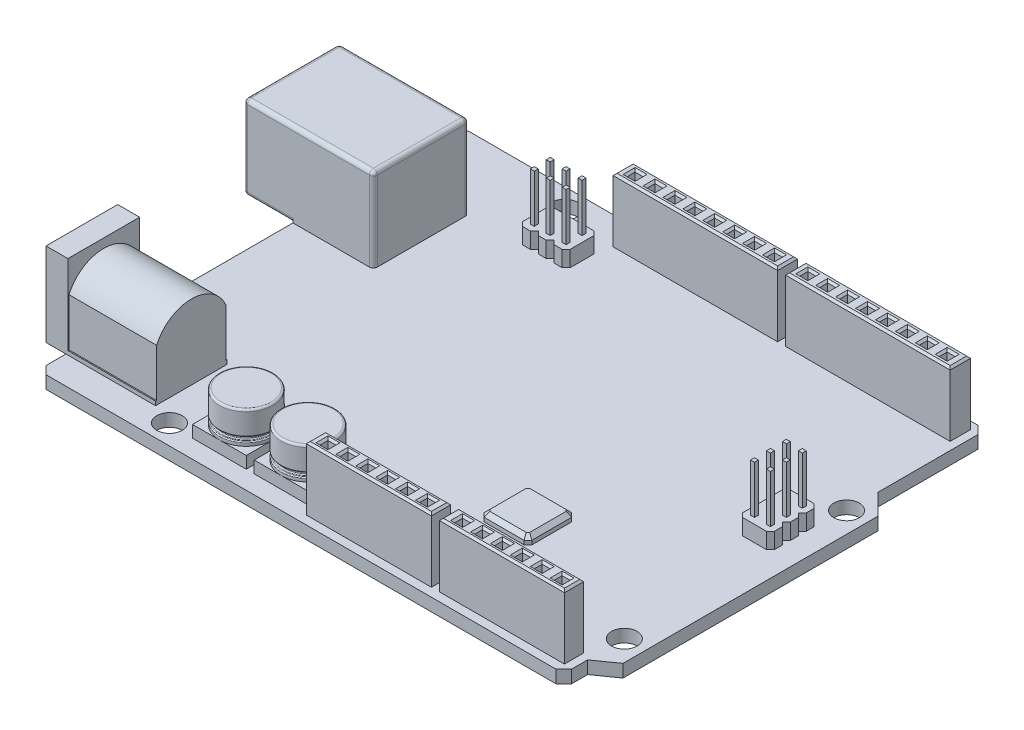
SolidWorks part; units mm, degrees
ref_plane "Front Plane" through (0, 0, 0) normal (0, 0, 1) x (1, 0, 0)
ref_plane "Top Plane" through (0, 0, 0) normal (0, 1, 0) x (1, 0, 0)
ref_plane "Right Plane" through (0, 0, 0) normal (1, 0, 0) x (0, 0, -1)
sketch "Sketch1" plane through (0, 0, 0) normal (0, 1, 0) x (1, 0, 0)
  line L0 (33, 12.9334) -> (35.6, 10.3334)
  line L1 (-33, -26.5) -> (33, -26.5)
  line L2 (-33, -26.5) -> (-33, 26.5)
  line L3 (-33, 26.5) -> (33, 26.5)
  line L4 (33, -26.5) -> (33, -23.5)
  line L5 (-33, -26.5) -> (33, 26.5) construction
  line L6 (-33, 26.5) -> (33, -26.5) construction
  line L7 (35.6, 10.3334) -> (35.6, -21.6666)
  line L8 (35.6, -21.6666) -> (33, -23.5)
  line L9 (33, 12.9334) -> (33, 26.5)
  line L10 (-19, -24) -> (-19, 24) construction
  circle A0 centre (-17.4, 24) radius 1.6
  circle A1 centre (-19, -24) radius 1.6
  circle A2 centre (33, 9) radius 1.6
  circle A3 centre (33, -18.9) radius 1.6
  point P0 (0, 0)
  dimension "D3" = 3.2
  dimension "D8" = 3.2
  dimension "D1" = 66
  dimension "D2" = 53
  dimension "D4" = 3
  dimension "D5" = 32
  dimension "D6" = 45
  dimension "D7" = 68.6
  dimension "D9" = 27.9
  dimension "D10" = 5.1
  dimension "D11" = 2.5
  dimension "D12" = 2.5
  dimension "D13" = 14
extrude "Boss-Extrude1" add sketch "Sketch1" along normal blind 1.6
chamfer "Chamfer1" distance 1 angle 45 4 edges at (-33, 0.8, 26.5) (-33, 0.8, -26.5) (33, 0.8, -26.5) (33, 0.8, 26.5)
sketch "Sketch2" plane through (0, 1.6, 0) normal (0, 1, 0) x (1, 0, 0)
  line L0 (32, 26.5) -> (-32, 26.5) construction
  line L1 (-22.9, 5.5) -> (-39.2, 5.5)
  line L2 (-22.9, 5.5) -> (-22.9, 17.5)
  line L3 (-22.9, 17.5) -> (-39.2, 17.5)
  line L4 (-39.2, 5.5) -> (-39.2, 17.5)
  line L5 (-35.5, -14) -> (-21.75, -14)
  line L6 (-35.5, -14) -> (-35.5, -23)
  line L7 (-35.5, -23) -> (-21.75, -23)
  line L8 (-21.75, -14) -> (-21.75, -23)
  line L9 (-33, 25.5) -> (-33, -25.5) construction
  line L10 (-32, -26.5) -> (32, -26.5) construction
  dimension "D1" = 12
  dimension "D2" = 16.3
  dimension "D3" = 9
  dimension "D4" = 6.2
  dimension "D5" = 9
  dimension "D6" = 13.75
  dimension "D7" = 2.5
  dimension "D8" = 3.5
extrude "Boss-Extrude2" add sketch "Sketch2" along normal blind 10.5
sketch "Sketch3" plane through (-39.2, 0, 0) normal (-1, 0, 0) x (0, 0, 1)
  line L0 (-11.5, 12.1) -> (-11.5, 1.6) construction
  line L1 (-17.5, 12.1) -> (-5.5, 12.1) construction
  line L2 (-17.5, 1.6) -> (-5.5, 1.6) construction
  line L3 (-9.1605, 10.6) -> (-13.8395, 10.6)
  line L4 (-13.8395, 10.6) -> (-16, 8.1518)
  line L5 (-16, 8.1518) -> (-16, 3.1)
  line L6 (-16, 3.1) -> (-7, 3.1)
  line L7 (-8.81, 8.1518) -> (-14.19, 8.1518)
  line L8 (-14.19, 8.1518) -> (-14.19, 5.6518)
  line L9 (-14.19, 5.6518) -> (-11.5, 5.6518)
  line L10 (-8.81, 8.1518) -> (-8.81, 5.6518)
  line L11 (-8.81, 5.6518) -> (-11.5, 5.6518)
  line L12 (-7, 8.1518) -> (-7, 3.1)
  line L13 (-9.1605, 10.6) -> (-7, 8.1518)
  point P8 (-10.155, 5.6518)
  point P13 (-12.845, 5.6518)
  point P17 (-11.5, 3.1)
  point P19 (-11.5, 8.1518)
  point P22 (-11.5, 10.6)
  dimension "D1" = 9
  dimension "D2" = 2.5
  dimension "D3" = 7.5
  dimension "D4" = 1.5
  dimension "D5" = 5.38
extrude "Cut-Extrude1" cut sketch "Sketch3" against normal blind 10
fillet "Fillet2" radius 0.5 11 edges at (-36.1, 1.6, -17.5) (-39.2, 1.6, -11.5) (-36.1, 1.6, -5.5) (-22.9, 12.1, -11.5) (-31.05, 12.1, -17.5) (-39.2, 12.1, -11.5) (-22.9, 6.85, -5.5) (-39.2, 6.85, -5.5) (-39.2, 6.85, -17.5) (-22.9, 6.85, -17.5) (-31.05, 12.1, -5.5)
sketch "Sketch4" plane through (-35.5, 0, 0) normal (-1, 0, 0) x (0, 0, 1)
  line L0 (18.5, 12.1) -> (18.5, 1.6) construction
  line L1 (14, 12.1) -> (23, 12.1) construction
  line L2 (14, 1.6) -> (23, 1.6) construction
  line L3 (14, 6.85) -> (23, 6.85) construction
  line L4 (14, 12.1) -> (14, 1.6) construction
  line L5 (23, 12.1) -> (23, 1.6) construction
  circle A0 centre (18.5, 6.85) radius 3.5
  circle A1 centre (18.5, 6.85) radius 0.5
  dimension "D1" = 7
  dimension "D2" = 1
extrude "Cut-Extrude2" cut sketch "Sketch4" against normal blind 10
sketch "Sketch6" plane through (-21.75, 0, 0) normal (1, 0, 0) x (0, 0, -1)
  line L0 (-23, 2.1) -> (-14, 2.1) construction
  line L1 (-23, 12.1) -> (-23, 1.6) construction
  line L2 (-14, 12.1) -> (-14, 1.6) construction
  line L3 (-18.5, 12.1) -> (-18.5, 2.1) construction
  line L4 (-23, 12.1) -> (-14, 12.1) construction
  line L5 (-23, 1.6) -> (-14, 1.6) construction
  line L6 (-14, 12.1) -> (-23, 12.1)
  line L7 (-23, 12.1) -> (-23, 2.1)
  line L8 (-23, 2.1) -> (-22.86, 2.1)
  line L9 (-22.86, 2.1) -> (-22.86, 8.1)
  line L10 (-14, 2.1) -> (-14.14, 2.1)
  line L11 (-14.14, 2.1) -> (-14.14, 8.1)
  line L12 (-14, 12.1) -> (-14, 2.1)
  arc A1 (-22.86, 8.1) -> (-14.14, 8.1) centre (-18.5, 6.2062) cw
  dimension "D1" = 0.5
  dimension "D2" = 0.14
  dimension "D3" = 6
extrude "Cut-Extrude5" cut sketch "Sketch6" against normal blind 11
fillet "Fillet3" radius 0.5 1 edges at (-35.5, 6.85, 19)
sketch "Sketch7" plane through (0, 1.6, 0) normal (0, 1, 0) x (1, 0, 0)
  line L0 (33, 12.9334) -> (33, 25.5) construction
  line L1 (-10.3, 25.5) -> (10.35, 25.5)
  line L2 (-10.3, 25.5) -> (-10.3, 23)
  line L3 (-10.3, 23) -> (10.35, 23)
  line L4 (10.35, 25.5) -> (10.35, 23)
  line L5 (11.35, 25.5656) -> (32, 25.5656)
  line L6 (11.35, 25.5656) -> (11.35, 23)
  line L7 (11.35, 23) -> (32, 23)
  line L8 (32, 25.5656) -> (32, 23)
  line L9 (-0.4, -23) -> (15.3, -23)
  line L10 (-0.4, -23) -> (-0.4, -25.4147)
  line L11 (-0.4, -25.4147) -> (15.3, -25.4147)
  line L12 (15.3, -23) -> (15.3, -25.4147)
  line L13 (16.3, -23) -> (32, -23)
  line L14 (16.3, -23) -> (16.3, -25.4147)
  line L15 (16.3, -25.4147) -> (32, -25.4147)
  line L16 (32, -23) -> (32, -25.4147)
  line L17 (-10.3, 24.25) -> (10.35, 24.25) construction
  line L18 (-6.8, 24.75) -> (-6.8, 23.75)
  line L19 (-9.3, 24.75) -> (-8.3, 24.75)
  line L20 (-9.3, 24.75) -> (-9.3, 23.75)
  line L21 (-9.3, 23.75) -> (-8.3, 23.75)
  line L22 (-8.3, 24.75) -> (-8.3, 23.75)
  line L23 (-6.8, 24.75) -> (-5.8, 24.75)
  line L24 (-5.8, 24.75) -> (-5.8, 23.75)
  line L25 (-6.8, 23.75) -> (-5.8, 23.75)
  line L26 (-4.3, 24.75) -> (-4.3, 23.75)
  line L27 (-4.3, 24.75) -> (-3.3, 24.75)
  line L28 (-3.3, 24.75) -> (-3.3, 23.75)
  line L29 (-4.3, 23.75) -> (-3.3, 23.75)
  line L30 (-1.8, 24.75) -> (-1.8, 23.75)
  line L31 (-1.8, 24.75) -> (-0.8, 24.75)
  line L32 (-0.8, 24.75) -> (-0.8, 23.75)
  line L33 (-1.8, 23.75) -> (-0.8, 23.75)
  line L34 (0.7, 24.75) -> (0.7, 23.75)
  line L35 (0.7, 24.75) -> (1.7, 24.75)
  line L36 (1.7, 24.75) -> (1.7, 23.75)
  line L37 (0.7, 23.75) -> (1.7, 23.75)
  line L38 (3.2, 24.75) -> (3.2, 23.75)
  line L39 (3.2, 24.75) -> (4.2, 24.75)
  line L40 (4.2, 24.75) -> (4.2, 23.75)
  line L41 (3.2, 23.75) -> (4.2, 23.75)
  line L42 (5.7, 24.75) -> (5.7, 23.75)
  line L43 (5.7, 24.75) -> (6.7, 24.75)
  line L44 (6.7, 24.75) -> (6.7, 23.75)
  line L45 (5.7, 23.75) -> (6.7, 23.75)
  line L46 (8.2, 24.75) -> (8.2, 23.75)
  line L47 (8.2, 24.75) -> (9.2, 24.75)
  line L48 (9.2, 24.75) -> (9.2, 23.75)
  line L49 (8.2, 23.75) -> (9.2, 23.75)
  line L50 (11.35, 24.2828) -> (32, 24.2828) construction
  line L51 (14.85, 24.7828) -> (14.85, 23.7828)
  line L52 (12.35, 24.7828) -> (13.35, 24.7828)
  line L53 (12.35, 24.7828) -> (12.35, 23.7828)
  line L54 (12.35, 23.7828) -> (13.35, 23.7828)
  line L55 (13.35, 24.7828) -> (13.35, 23.7828)
  line L56 (14.85, 24.7828) -> (15.85, 24.7828)
  line L57 (15.85, 24.7828) -> (15.85, 23.7828)
  line L58 (14.85, 23.7828) -> (15.85, 23.7828)
  line L59 (17.35, 24.7828) -> (17.35, 23.7828)
  line L60 (17.35, 24.7828) -> (18.35, 24.7828)
  line L61 (18.35, 24.7828) -> (18.35, 23.7828)
  line L62 (17.35, 23.7828) -> (18.35, 23.7828)
  line L63 (19.85, 24.7828) -> (19.85, 23.7828)
  line L64 (19.85, 24.7828) -> (20.85, 24.7828)
  line L65 (20.85, 24.7828) -> (20.85, 23.7828)
  line L66 (19.85, 23.7828) -> (20.85, 23.7828)
  line L67 (22.35, 24.7828) -> (22.35, 23.7828)
  line L68 (22.35, 24.7828) -> (23.35, 24.7828)
  line L69 (23.35, 24.7828) -> (23.35, 23.7828)
  line L70 (22.35, 23.7828) -> (23.35, 23.7828)
  line L71 (24.85, 24.7828) -> (24.85, 23.7828)
  line L72 (24.85, 24.7828) -> (25.85, 24.7828)
  line L73 (25.85, 24.7828) -> (25.85, 23.7828)
  line L74 (24.85, 23.7828) -> (25.85, 23.7828)
  line L75 (27.35, 24.7828) -> (27.35, 23.7828)
  line L76 (27.35, 24.7828) -> (28.35, 24.7828)
  line L77 (28.35, 24.7828) -> (28.35, 23.7828)
  line L78 (27.35, 23.7828) -> (28.35, 23.7828)
  line L79 (29.85, 24.7828) -> (29.85, 23.7828)
  line L80 (29.85, 24.7828) -> (30.85, 24.7828)
  line L81 (30.85, 24.7828) -> (30.85, 23.7828)
  line L82 (29.85, 23.7828) -> (30.85, 23.7828)
  line L83 (33, -25.5) -> (33, -23.5) construction
  line L84 (15.3, -24.2074) -> (16.3, -24.2074) construction
  line L85 (15.8, -23.4583) -> (15.8, -24.6215) construction
  line L86 (-0.4, -24.2074) -> (15.3, -24.2074) construction
  line L87 (3.1, -23.7074) -> (3.1, -24.7074)
  line L88 (0.6, -23.7074) -> (1.6, -23.7074)
  line L89 (0.6, -23.7074) -> (0.6, -24.7074)
  line L90 (0.6, -24.7074) -> (1.6, -24.7074)
  line L91 (1.6, -23.7074) -> (1.6, -24.7074)
  line L92 (3.1, -23.7074) -> (4.1, -23.7074)
  line L93 (4.1, -23.7074) -> (4.1, -24.7074)
  line L94 (3.1, -24.7074) -> (4.1, -24.7074)
  line L95 (5.6, -23.7074) -> (5.6, -24.7074)
  line L96 (5.6, -23.7074) -> (6.6, -23.7074)
  line L97 (6.6, -23.7074) -> (6.6, -24.7074)
  line L98 (5.6, -24.7074) -> (6.6, -24.7074)
  line L99 (8.1, -23.7074) -> (8.1, -24.7074)
  line L100 (8.1, -23.7074) -> (9.1, -23.7074)
  line L101 (9.1, -23.7074) -> (9.1, -24.7074)
  line L102 (8.1, -24.7074) -> (9.1, -24.7074)
  line L103 (10.6, -23.7074) -> (10.6, -24.7074)
  line L104 (10.6, -23.7074) -> (11.6, -23.7074)
  line L105 (11.6, -23.7074) -> (11.6, -24.7074)
  line L106 (10.6, -24.7074) -> (11.6, -24.7074)
  line L107 (13.1, -23.7074) -> (13.1, -24.7074)
  line L108 (13.1, -23.7074) -> (14.1, -23.7074)
  line L109 (14.1, -23.7074) -> (14.1, -24.7074)
  line L110 (13.1, -24.7074) -> (14.1, -24.7074)
  line L111 (18.5, -23.7074) -> (17.5, -23.7074)
  line L112 (17.5, -23.7074) -> (17.5, -24.7074)
  line L113 (18.5, -24.7074) -> (17.5, -24.7074)
  line L114 (18.5, -23.7074) -> (18.5, -24.7074)
  line L115 (21, -23.7074) -> (20, -23.7074)
  line L116 (20, -23.7074) -> (20, -24.7074)
  line L117 (21, -24.7074) -> (20, -24.7074)
  line L118 (21, -23.7074) -> (21, -24.7074)
  line L119 (23.5, -23.7074) -> (22.5, -23.7074)
  line L120 (22.5, -23.7074) -> (22.5, -24.7074)
  line L121 (23.5, -24.7074) -> (22.5, -24.7074)
  line L122 (23.5, -23.7074) -> (23.5, -24.7074)
  line L123 (26, -23.7074) -> (25, -23.7074)
  line L124 (25, -23.7074) -> (25, -24.7074)
  line L125 (26, -24.7074) -> (25, -24.7074)
  line L126 (26, -23.7074) -> (26, -24.7074)
  line L127 (28.5, -23.7074) -> (27.5, -23.7074)
  line L128 (27.5, -23.7074) -> (27.5, -24.7074)
  line L129 (28.5, -24.7074) -> (27.5, -24.7074)
  line L130 (28.5, -23.7074) -> (28.5, -24.7074)
  line L131 (31, -24.7074) -> (30, -24.7074)
  line L132 (30, -23.7074) -> (30, -24.7074)
  line L133 (31, -23.7074) -> (30, -23.7074)
  line L134 (31, -23.7074) -> (31, -24.7074)
  point P16 (11.35, 24.2828)
  point P19 (33, 19.2167)
  dimension "D1" = 20.65
  dimension "D2" = 2.5
  dimension "D3" = 1
  dimension "D4" = 20.65
  dimension "D5" = 1
  dimension "D6" = 1
  dimension "D7" = 0.5
  dimension "D8" = 1
  dimension "D10" = 1
  dimension "D11" = 0.5
  dimension "D12" = 1
  dimension "D14" = 23
  dimension "D15" = 23
  dimension "D16" = 23
  dimension "D17" = 23
  dimension "D18" = 15.7
  dimension "D19" = 1
  dimension "D20" = 1
  dimension "D21" = 1
  dimension "D22" = 1
  dimension "D23" = 0.5
  dimension "D9" = 8
  dimension "D13" = 8
  dimension "D24" = 6
extrude "Boss-Extrude3" add sketch "Sketch7" along normal blind 8
chamfer "Chamfer2" distance 0.25 angle 45 128 edges at (13.6, 9.6, 24.7074) (14.1, 9.6, 24.2074) (13.6, 9.6, 23.7074) (13.1, 9.6, 24.2074) (11.1, 9.6, 24.7074) (11.6, 9.6, 24.2074) (11.1, 9.6, 23.7074) (10.6, 9.6, 24.2074) (8.6, 9.6, 24.7074) (9.1, 9.6, 24.2074) (8.6, 9.6, 23.7074) (8.1, 9.6, 24.2074) (6.1, 9.6, 24.7074) (6.6, 9.6, 24.2074) (6.1, 9.6, 23.7074) (5.6, 9.6, 24.2074) (3.6, 9.6, 24.7074) (4.1, 9.6, 24.2074) (3.6, 9.6, 23.7074) (3.1, 9.6, 24.2074) (1.6, 9.6, 24.2074) (1.1, 9.6, 23.7074) (0.6, 9.6, 24.2074) (1.1, 9.6, 24.7074) (7.45, 9.6, 23) (15.3, 9.6, 24.2074) (7.45, 9.6, 25.4147) (-0.4, 9.6, 24.2074) (30, 9.6, 24.2074) (30.5, 9.6, 24.7074) (31, 9.6, 24.2074) (30.5, 9.6, 23.7074) (27.5, 9.6, 24.2074) (28, 9.6, 24.7074) (28.5, 9.6, 24.2074) (28, 9.6, 23.7074) (25, 9.6, 24.2074) (25.5, 9.6, 24.7074) (26, 9.6, 24.2074) (25.5, 9.6, 23.7074) (22.5, 9.6, 24.2074) (23, 9.6, 24.7074) (23.5, 9.6, 24.2074) (23, 9.6, 23.7074) (20, 9.6, 24.2074) (20.5, 9.6, 24.7074) (21, 9.6, 24.2074) (20.5, 9.6, 23.7074) (17.5, 9.6, 24.2074) (18, 9.6, 24.7074) (18.5, 9.6, 24.2074) (18, 9.6, 23.7074) (24.15, 9.6, 23) (32, 9.6, 24.2074) (24.15, 9.6, 25.4147) (16.3, 9.6, 24.2074) (30.35, 9.6, -23.7828) (30.85, 9.6, -24.2828) (30.35, 9.6, -24.7828) (29.85, 9.6, -24.2828) (27.85, 9.6, -23.7828) (28.35, 9.6, -24.2828) (27.85, 9.6, -24.7828) (27.35, 9.6, -24.2828) (25.35, 9.6, -23.7828) (25.85, 9.6, -24.2828) (25.35, 9.6, -24.7828) (24.85, 9.6, -24.2828) (22.85, 9.6, -23.7828) (23.35, 9.6, -24.2828) (22.85, 9.6, -24.7828) (22.35, 9.6, -24.2828) (20.35, 9.6, -23.7828) (20.85, 9.6, -24.2828) (20.35, 9.6, -24.7828) (19.85, 9.6, -24.2828) (17.85, 9.6, -23.7828) (18.35, 9.6, -24.2828) (17.85, 9.6, -24.7828) (17.35, 9.6, -24.2828) (15.35, 9.6, -23.7828) (15.85, 9.6, -24.2828) (15.35, 9.6, -24.7828) (14.85, 9.6, -24.2828) (13.35, 9.6, -24.2828) (12.85, 9.6, -24.7828) (12.35, 9.6, -24.2828) (12.85, 9.6, -23.7828) (21.675, 9.6, -25.5656) (32, 9.6, -24.2828) (21.675, 9.6, -23) (11.35, 9.6, -24.2828) (8.7, 9.6, -23.75) (9.2, 9.6, -24.25) (8.7, 9.6, -24.75) (8.2, 9.6, -24.25) (6.2, 9.6, -23.75) (6.7, 9.6, -24.25) (6.2, 9.6, -24.75) (5.7, 9.6, -24.25) (3.7, 9.6, -23.75) (4.2, 9.6, -24.25) (3.7, 9.6, -24.75) (3.2, 9.6, -24.25) (1.2, 9.6, -23.75) (1.7, 9.6, -24.25) (1.2, 9.6, -24.75) (0.7, 9.6, -24.25) (-1.3, 9.6, -23.75) (-0.8, 9.6, -24.25) (-1.3, 9.6, -24.75) (-1.8, 9.6, -24.25) (-3.8, 9.6, -23.75) (-3.3, 9.6, -24.25) (-3.8, 9.6, -24.75) (-4.3, 9.6, -24.25) (-6.3, 9.6, -23.75) (-5.8, 9.6, -24.25) (-6.3, 9.6, -24.75) (-6.8, 9.6, -24.25) (-8.3, 9.6, -24.25) (-8.8, 9.6, -24.75) (-9.3, 9.6, -24.25) (-8.8, 9.6, -23.75) (0.025, 9.6, -25.5) (10.35, 9.6, -24.25) (0.025, 9.6, -23) (-10.3, 9.6, -24.25)
sketch "Sketch8" plane through (0, 1.6, 0) normal (0, 1, 0) x (1, 0, 0)
  line L0 (-0.4, -25.4147) -> (-0.4, -23) construction
  line L1 (-8.15, -17.4574) -> (-1.4, -17.4574)
  line L2 (-8.15, -17.4574) -> (-8.15, -24.2074)
  line L3 (-8.15, -24.2074) -> (-1.4, -24.2074)
  line L4 (-1.4, -17.4574) -> (-1.4, -24.2074)
  line L5 (-15.9, -17.4574) -> (-9.15, -17.4574)
  line L6 (-15.9, -17.4574) -> (-15.9, -24.2074)
  line L7 (-15.9, -24.2074) -> (-9.15, -24.2074)
  line L8 (-9.15, -17.4574) -> (-9.15, -24.2074)
  point P10 (-0.4, -24.2074)
  dimension "D1" = 6.75
  dimension "D2" = 1
  dimension "D3" = 1
  dimension "D4" = 0
  dimension "D5" = 0
extrude "Boss-Extrude4" add sketch "Sketch8" along normal blind 1.5
sketch "Sketch9" plane through (0, 3.1, 0) normal (0, 1, 0) x (1, 0, 0)
  circle A0 centre (-12.525, -20.8324) radius 3.375
  circle A1 centre (-4.775, -20.8324) radius 3.375
extrude "Boss-Extrude5" add sketch "Sketch9" along normal blind 4
fillet "Fillet4" radius 0.25 2 edges at (-4.775, 7.1, 24.2074) (-12.525, 7.1, 24.2074)
ref_plane "Plane1" through (0, 4.1, 0) normal (0, 1, 0) x (1, 0, 0)
sketch "Sketch10" plane through (0, 4.1, 0) normal (0, 1, 0) x (1, 0, 0)
  line L0 (-9.15, -20.8324) -> (-8.15, -20.8324) construction
  line L1 (-9.15, -24.2074) -> (-9.15, -17.4574) construction
  line L2 (-8.65, -19.5166) -> (-8.65, -21.6867) construction
  circle A0 centre (-4.775, -20.8324) radius 3.375
  circle A1 centre (-4.775, -20.8324) radius 3
  circle A2 centre (-12.525, -20.8324) radius 3.375
  circle A3 centre (-12.525, -20.8324) radius 3
  dimension "D1" = 6.75
  dimension "D2" = 6
extrude "Cut-Extrude6" cut sketch "Sketch10" against normal blind 0.5
fillet "Fillet5" radius 0.125 8 edges at (-4.775, 3.6, 24.2074) (-4.775, 3.6, 23.8324) (-4.775, 4.1, 23.8324) (-4.775, 4.1, 24.2074) (-12.525, 3.6, 17.4574) (-12.525, 3.6, 17.8324) (-12.525, 4.1, 17.8324) (-12.525, 4.1, 17.4574)
sketch "Sketch11" plane through (0, 1.6, 0) normal (0, 1, 0) x (1, 0, 0)
  line L5 (29.2394, 5.7007) -> (28.7394, 5.2007)
  line L6 (32.7394, 4.2007) -> (32.7394, 5.2007)
  line L11 (32.2394, 5.7007) -> (29.2394, 5.7007)
  line L12 (28.7394, 4.2007) -> (28.7394, 5.2007)
  line L17 (32.7394, 3.7007) -> (28.7394, 5.7007) construction
  line L18 (32.7394, 5.7007) -> (28.7394, 3.7007) construction
  line L21 (29.2394, 3.7007) -> (28.7394, 4.2007)
  line L22 (32.7394, 4.2007) -> (32.2394, 3.7007)
  line L23 (32.7394, 5.2007) -> (32.2394, 5.7007)
  line L35 (29.2394, 3.7007) -> (28.7394, 3.2007)
  line L36 (32.7394, 2.2007) -> (32.7394, 3.2007)
  line L37 (28.7394, 2.2007) -> (28.7394, 3.2007)
  line L38 (32.7394, 1.7007) -> (28.7394, 3.7007) construction
  line L39 (32.7394, 3.7007) -> (28.7394, 1.7007) construction
  line L40 (29.2394, 1.7007) -> (28.7394, 2.2007)
  line L41 (32.7394, 2.2007) -> (32.2394, 1.7007)
  line L42 (32.7394, 3.2007) -> (32.2394, 3.7007)
  line L43 (29.2394, 1.7007) -> (28.7394, 1.2007)
  line L44 (32.2394, -0.2993) -> (29.2394, -0.2993)
  line L45 (32.7394, 0.2007) -> (32.7394, 1.2007)
  line L46 (28.7394, 0.2007) -> (28.7394, 1.2007)
  line L47 (32.7394, -0.2993) -> (28.7394, 1.7007) construction
  line L48 (32.7394, 1.7007) -> (28.7394, -0.2993) construction
  line L49 (29.2394, -0.2993) -> (28.7394, 0.2007)
  line L50 (32.7394, 0.2007) -> (32.2394, -0.2993)
  line L51 (32.7394, 1.2007) -> (32.2394, 1.7007)
  line L52 (-16.2317, 21.5277) -> (-16.7317, 21.0277)
  line L53 (-15.2317, 17.5277) -> (-16.2317, 17.5277)
  line L54 (-15.2317, 21.5277) -> (-16.2317, 21.5277)
  line L55 (-16.7317, 18.0277) -> (-16.7317, 21.0277)
  line L56 (-14.7317, 17.5277) -> (-16.7317, 21.5277) construction
  line L57 (-14.7317, 21.5277) -> (-16.7317, 17.5277) construction
  line L58 (-14.7317, 21.0277) -> (-15.2317, 21.5277)
  line L59 (-15.2317, 17.5277) -> (-14.7317, 18.0277)
  line L60 (-16.2317, 17.5277) -> (-16.7317, 18.0277)
  line L61 (-14.2317, 21.5277) -> (-14.7317, 21.0277)
  line L62 (-13.2317, 17.5277) -> (-14.2317, 17.5277)
  line L63 (-13.2317, 21.5277) -> (-14.2317, 21.5277)
  line L64 (-12.7317, 17.5277) -> (-14.7317, 21.5277) construction
  line L65 (-12.7317, 21.5277) -> (-14.7317, 17.5277) construction
  line L66 (-12.7317, 21.0277) -> (-13.2317, 21.5277)
  line L67 (-13.2317, 17.5277) -> (-12.7317, 18.0277)
  line L68 (-14.2317, 17.5277) -> (-14.7317, 18.0277)
  line L69 (-12.2317, 21.5277) -> (-12.7317, 21.0277)
  line L70 (-11.2317, 17.5277) -> (-12.2317, 17.5277)
  line L71 (-10.7317, 18.0277) -> (-10.7317, 21.0277)
  line L72 (-11.2317, 21.5277) -> (-12.2317, 21.5277)
  line L73 (-10.7317, 17.5277) -> (-12.7317, 21.5277) construction
  line L74 (-10.7317, 21.5277) -> (-12.7317, 17.5277) construction
  line L75 (-10.7317, 21.0277) -> (-11.2317, 21.5277)
  line L76 (-11.2317, 17.5277) -> (-10.7317, 18.0277)
  line L77 (-12.2317, 17.5277) -> (-12.7317, 18.0277)
  point P0 (30.7394, 4.7007)
  point P13 (30.7394, 2.7007)
  point P24 (30.7394, 0.7007)
  point P35 (-15.7317, 19.5277)
  point P48 (-13.7317, 19.5277)
  point P59 (-11.7317, 19.5277)
  dimension "D1" = 0.5
  dimension "D2" = 0.5
  dimension "D3" = 0.5
  dimension "D4" = 0.5
  dimension "D5" = 0.5
  dimension "D6" = 0.5
  dimension "D7" = 0.5
  dimension "D8" = 0.5
  dimension "D9" = 4
  dimension "D10" = 0.5
  dimension "D11" = 0.5
  dimension "D12" = 0.5
  dimension "D13" = 0.5
  dimension "D14" = 0.5
  dimension "D15" = 0.5
  dimension "D16" = 0.5
  dimension "D17" = 0.5
  dimension "D18" = 4
  dimension "D19" = 0.5
  dimension "D20" = 0.5
  dimension "D21" = 0.5
  dimension "D22" = 0.5
  dimension "D23" = 0.5
  dimension "D24" = 0.5
  dimension "D25" = 0.5
  dimension "D26" = 0.5
  dimension "D27" = 6
  dimension "D28" = 0.5
  dimension "D29" = 0.5
  dimension "D30" = 0.5
  dimension "D31" = 0.5
  dimension "D32" = 0.5
  dimension "D33" = 0.5
  dimension "D34" = 0.5
  dimension "D35" = 0.5
  dimension "D36" = 0.5
  dimension "D37" = 0.5
  dimension "D38" = 0.5
  dimension "D39" = 0.5
  dimension "D40" = 0.5
  dimension "D41" = 0.5
  dimension "D42" = 0.5
  dimension "D43" = 0.5
  dimension "D44" = 0.5
  dimension "D45" = 0.5
  dimension "D46" = 0.5
  dimension "D47" = 0.5
extrude "Boss-Extrude6" add sketch "Sketch11" along normal blind 2
sketch "Sketch12" plane through (0, 3.6, 0) normal (0, 1, 0) x (1, 0, 0)
  line L0 (28.7394, 4.7007) -> (32.7394, 4.7007) construction
  line L1 (29.4894, 4.9507) -> (29.9894, 4.9507)
  line L2 (29.4894, 4.9507) -> (29.4894, 4.4507)
  line L3 (29.4894, 4.4507) -> (29.9894, 4.4507)
  line L4 (29.9894, 4.9507) -> (29.9894, 4.4507)
  line L5 (28.7394, 5.2007) -> (28.7394, 4.2007) construction
  line L6 (32.7394, 4.2007) -> (32.7394, 5.2007) construction
  line L7 (31.4894, 4.9507) -> (31.4894, 4.4507)
  line L8 (31.4894, 4.9507) -> (31.9894, 4.9507)
  line L9 (31.9894, 4.9507) -> (31.9894, 4.4507)
  line L10 (31.4894, 4.4507) -> (31.9894, 4.4507)
  line L11 (-14.7317, 21.0277) -> (-14.7317, 18.0277) construction
  line L12 (29.2394, 3.7007) -> (32.2252, 3.7007) construction
  line L13 (29.2394, 1.7007) -> (32.2394, 1.7007) construction
  line L14 (31.4894, 2.4507) -> (31.9894, 2.4507)
  line L15 (31.9894, 2.4507) -> (31.9894, 2.9507)
  line L16 (31.4894, 2.9507) -> (31.9894, 2.9507)
  line L17 (31.4894, 2.4507) -> (31.4894, 2.9507)
  line L18 (29.4894, 2.9507) -> (29.9894, 2.9507)
  line L19 (29.9894, 2.4507) -> (29.9894, 2.9507)
  line L20 (29.4894, 2.4507) -> (29.9894, 2.4507)
  line L21 (29.4894, 2.4507) -> (29.4894, 2.9507)
  line L22 (31.4894, 0.9507) -> (31.4894, 0.4507)
  line L23 (31.4894, 0.4507) -> (31.9894, 0.4507)
  line L24 (31.9894, 0.9507) -> (31.9894, 0.4507)
  line L25 (31.4894, 0.9507) -> (31.9894, 0.9507)
  line L26 (29.4894, 0.9507) -> (29.4894, 0.4507)
  line L27 (29.4894, 0.9507) -> (29.9894, 0.9507)
  line L28 (29.9894, 0.9507) -> (29.9894, 0.4507)
  line L29 (29.4894, 0.4507) -> (29.9894, 0.4507)
  line L30 (-15.7317, 17.5277) -> (-15.7317, 21.5277) construction
  line L31 (-15.9817, 18.7777) -> (-15.4817, 18.7777)
  line L32 (-15.9817, 18.7777) -> (-15.9817, 18.2777)
  line L33 (-15.9817, 18.2777) -> (-15.4817, 18.2777)
  line L34 (-15.4817, 18.7777) -> (-15.4817, 18.2777)
  line L35 (-16.2317, 17.5277) -> (-15.2317, 17.5277) construction
  line L36 (-15.2317, 21.5277) -> (-16.2317, 21.5277) construction
  line L37 (-16.2317, 17.5277) -> (-15.2317, 17.5277) construction
  line L38 (-12.7317, 21.0277) -> (-12.7317, 18.0277) construction
  line L39 (-16.7317, 19.5277) -> (-10.7317, 19.5277) construction
  line L40 (-16.7317, 21.0277) -> (-16.7317, 18.0277) construction
  line L41 (-10.7317, 18.0277) -> (-10.7317, 21.0277) construction
  line L42 (-15.9817, 20.7777) -> (-15.4817, 20.7777)
  line L43 (-15.4817, 20.2777) -> (-15.4817, 20.7777)
  line L44 (-15.9817, 20.2777) -> (-15.4817, 20.2777)
  line L45 (-15.9817, 20.2777) -> (-15.9817, 20.7777)
  line L46 (-13.4817, 18.2777) -> (-13.9817, 18.2777)
  line L47 (-13.9817, 18.7777) -> (-13.9817, 18.2777)
  line L48 (-13.4817, 18.7777) -> (-13.9817, 18.7777)
  line L49 (-13.4817, 18.7777) -> (-13.4817, 18.2777)
  line L50 (-13.4817, 20.2777) -> (-13.4817, 20.7777)
  line L51 (-13.4817, 20.2777) -> (-13.9817, 20.2777)
  line L52 (-13.9817, 20.2777) -> (-13.9817, 20.7777)
  line L53 (-13.4817, 20.7777) -> (-13.9817, 20.7777)
  line L54 (-11.9817, 18.7777) -> (-11.9817, 18.2777)
  line L55 (-11.9817, 18.7777) -> (-11.4817, 18.7777)
  line L56 (-11.4817, 18.7777) -> (-11.4817, 18.2777)
  line L57 (-11.9817, 18.2777) -> (-11.4817, 18.2777)
  line L58 (-11.9817, 20.2777) -> (-11.4817, 20.2777)
  line L59 (-11.4817, 20.2777) -> (-11.4817, 20.7777)
  line L60 (-11.9817, 20.7777) -> (-11.4817, 20.7777)
  line L61 (-11.9817, 20.2777) -> (-11.9817, 20.7777)
  point P10 (29.4894, 4.7007)
  point P48 (-15.7317, 18.7777)
  dimension "D1" = 0.5
  dimension "D2" = 0.75
  dimension "D4" = 0.5
  dimension "D5" = 0.75
  dimension "D3" = 2
extrude "Boss-Extrude7" add sketch "Sketch12" along normal up to surface (6 mm away)
sketch "Sketch13" plane through (0, 1.6, 0) normal (0, 1, 0) x (1, 0, 0)
  line L1 (11, -15) -> (17, -15)
  line L2 (11, -15) -> (11, -9)
  line L3 (11, -9) -> (17, -9)
  line L4 (17, -15) -> (17, -9)
  point P4 (14, -9)
  point P6 (17, -12)
  point P8 (6.5923, -5.1102)
  dimension "D1" = 6
  dimension "D2" = 14
  dimension "D3" = 12
extrude "Boss-Extrude8" add sketch "Sketch13" along normal blind 1 contours L2 L1 L4 L3
chamfer "Chamfer3" distance 0.5 angle 45 4 edges at (11, 2.1, 15) (17, 2.1, 15) (17, 2.1, 9) (11, 2.1, 9)
chamfer "Chamfer4" distance 0.5 angle 45 8 edges at (11.25, 2.6, 9.25) (14, 2.6, 9) (16.75, 2.6, 9.25) (17, 2.6, 12) (16.75, 2.6, 14.75) (14, 2.6, 15) (11.25, 2.6, 14.75) (11, 2.6, 12)
